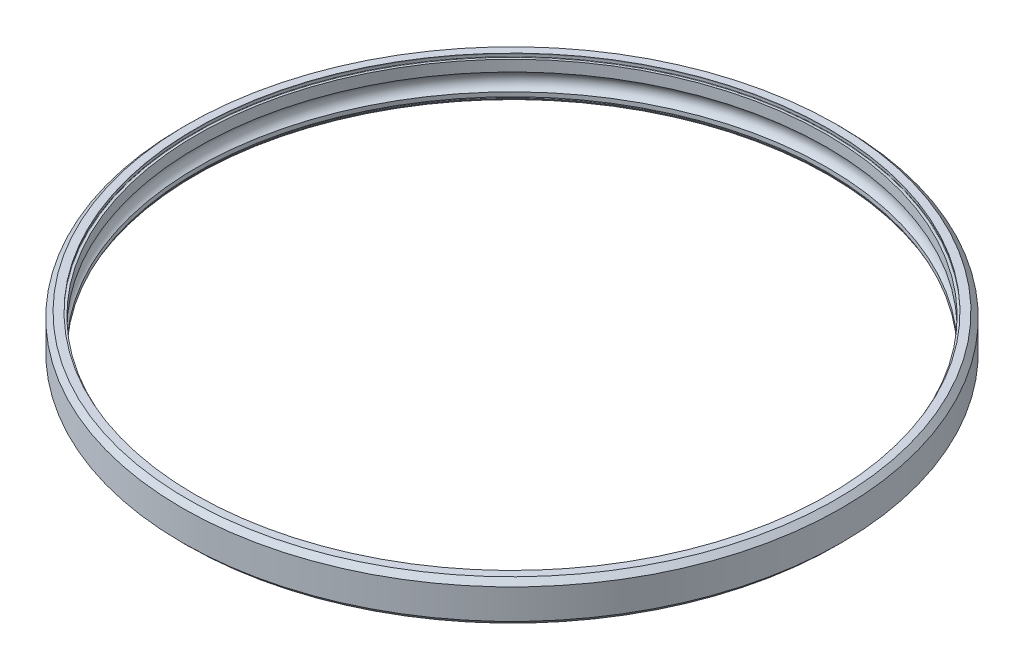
SolidWorks part; units mm, degrees
ref_plane "Front" through (0, 0, 0) normal (0, 0, 1) x (1, 0, 0)
ref_plane "Top" through (0, 0, 0) normal (0, 1, 0) x (1, 0, 0)
ref_plane "Right" through (0, 0, 0) normal (1, 0, 0) x (0, 0, -1)
sketch "Sketch1" plane through (0, 0, 0) normal (0, 0, 1) x (1, 0, 0)
  line L0 (0, 0) -> (0, 16.1344) construction
  line L1 (0, 0) -> (-33.4493, 0) construction
  line L2 (-62.1411, -3.2944) -> (-62.1411, 4.6431)
  line L3 (-62.1411, -3.2944) -> (-65.0875, -3.2944)
  line L5 (-62.1411, 4.6431) -> (-65.0875, 4.6431)
  line L6 (-65.0875, -3.2944) -> (-65.0875, 4.6431)
  dimension "OUTSIDE DIAMETER" = 130.175
  dimension "D3" = 4.6431
  dimension "D4" = 7.9375
  dimension "LAND DIA L2" = 124.2822
revolve "Base-Revolve" add sketch "Sketch1" angle 360 about L0
sketch "Sketch of Path" plane through (0, 0, 0) normal (0, 0, 1) x (1, 0, 0)
  line L0 (0, 0) -> (-32.6034, 0) construction
  line L1 (0, 0) -> (0, 6.2493) construction
  line L2 (0, 0) -> (0, 16.1344) construction
  line L3 (-62.1411, 1.7) -> (-62.1411, -1.7)
  arc A0 (-62.1411, 1.7) -> (-62.1411, -1.7) centre (-61.1187, 0) ccw
  dimension "D2" = 1.9837
  dimension "PITCH DIA" = 122.2375
  dimension "I.D. OF PATH" = 124.2822
revolve "Cut-Revolve Path" cut sketch "Sketch of Path" angle 360 about L1
chamfer "O.D. Chamfer" distance 1.016 angle 45 2 edges at (0, 4.6431, -65.0875) (0, -3.2944, -65.0875)
sketch "Sketch2" plane through (0, 0, 0) normal (0, 0, 1) x (1, 0, 0)
  line L0 (-62.1411, 4.6431) -> (-62.1411, 1.7) construction
  line L1 (-62.1411, 3.8811) -> (-62.5983, 3.8811)
  line L2 (-62.1411, 3.8811) -> (-62.1411, 4.6431)
  line L3 (64.0715, 4.6431) -> (-64.0715, 4.6431) construction
  line L4 (-62.6745, 3.9573) -> (-62.6745, 4.4399)
  line L5 (0, 0) -> (0, 6.0814) construction
  line L6 (0, 0) -> (0, 16.1344) construction
  line L7 (-62.1411, 4.6431) -> (-62.5412, 4.6431)
  line L8 (-62.5412, 4.6431) -> (-62.5412, 4.5161)
  line L9 (-62.5412, 4.5161) -> (-62.5983, 4.5161)
  arc A0 (-62.6745, 4.4399) -> (-62.5983, 4.5161) centre (-62.5983, 4.4399) cw
  arc A1 (-62.6745, 3.9573) -> (-62.5983, 3.8811) centre (-62.5983, 3.9573) ccw
  dimension "D5" = 0.0762
  dimension "D6" = 0.0762
  dimension "D1" = 0.762
  dimension "D2" = 0.635
  dimension "D3" = 0.5334
  dimension "D4" = 0.4001
revolve "Cut-Revolve Seal Groove" cut sketch "Sketch2" angle 360 about L5
ref_plane "Plane at Center of Outer" through (0, 0.6744, 0) normal (0, 1, 0) x (-1, 0, 0)
mirror "Mirror Seal Groove" about plane through (0, 0.6744, 0) normal (0, 1, 0) of "Cut-Revolve Seal Groove"
